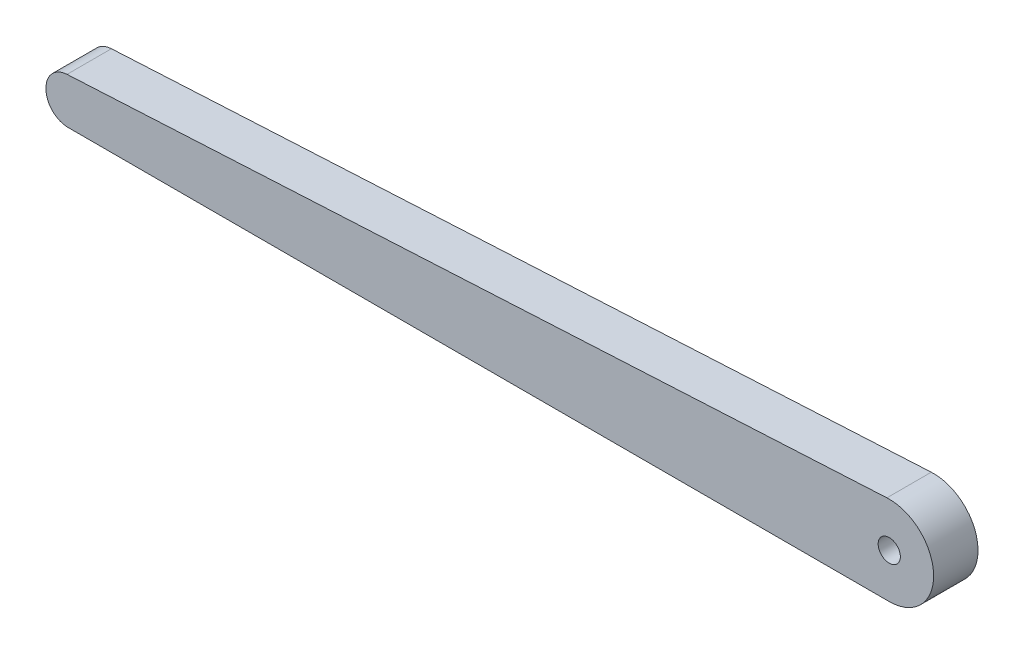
SolidWorks part; units mm, degrees
ref_plane "Plan de face" through (0, 0, 0) normal (0, 0, 1) x (1, 0, 0)
ref_plane "Plan de dessus" through (0, 0, 0) normal (0, 1, 0) x (1, 0, 0)
ref_plane "Plan de droite" through (0, 0, 0) normal (1, 0, 0) x (0, 0, -1)
sketch "Esquisse1" plane through (0, 0, 0) normal (0, 0, 1) x (1, 0, 0)
  line L0 (0, -2) -> (-37, -2)
  line L1 (-38, -1) -> (-38, -0.9487)
  line L2 (-37.0526, 0.0499) -> (-0.1053, 1.9972)
  arc A0 (0, -2) -> (-0.1053, 1.9972) centre (0, 0) ccw
  arc A1 (-37, -2) -> (-38, -1) centre (-37, -1) cw
  arc A2 (-37.0526, 0.0499) -> (-38, -0.9487) centre (-37, -0.9487) ccw
  circle A3 centre (0, 0) radius 0.5
  point P9 (-38, -2)
  point P12 (-38, 0)
  dimension "D1" = 38
  dimension "D3" = 1
  dimension "D2" = 2
extrude "Boss.-Extru.1" add sketch "Esquisse1" along normal mid plane 2
